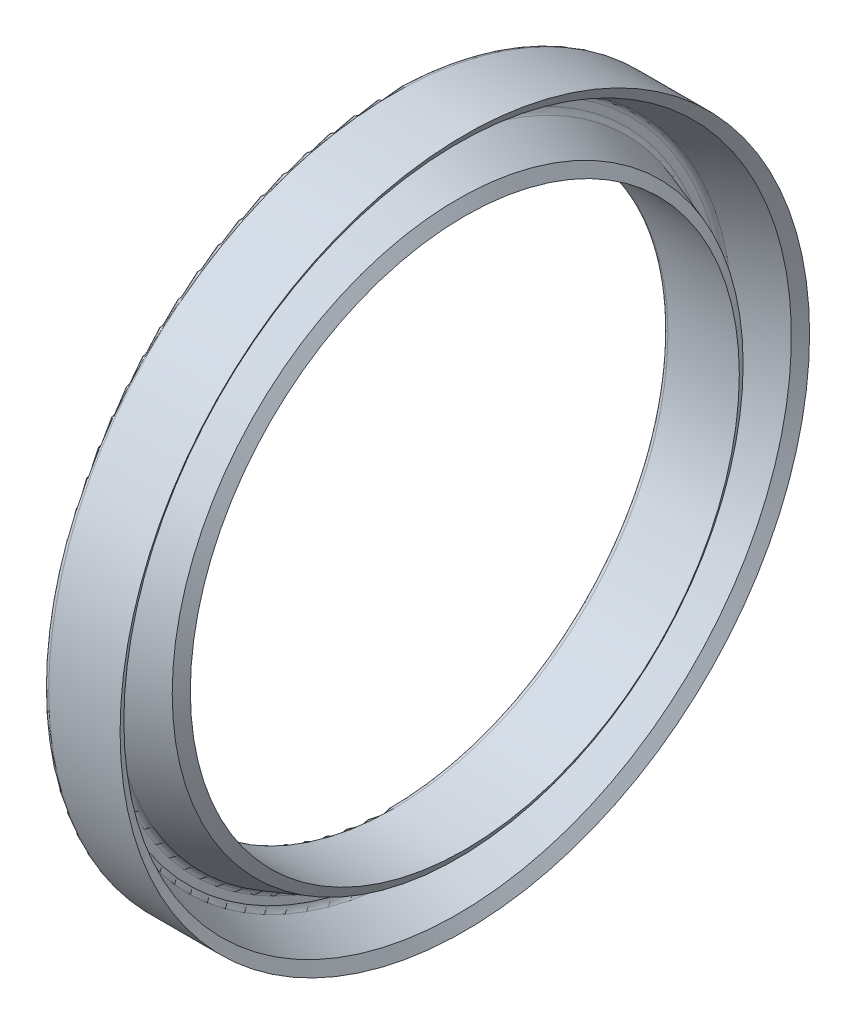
SolidWorks part; units mm, degrees
ref_plane "Face" through (0, 0, 0) normal (0, 0, 1) x (1, 0, 0)
ref_plane "Dessus" through (0, 0, 0) normal (0, 1, 0) x (1, 0, 0)
ref_plane "Droite" through (0, 0, 0) normal (1, 0, 0) x (0, 0, -1)
sketch "Esquisse1" plane through (0, 0, 0) normal (0, 0, 1) x (1, 0, 0)
  line L0 (0, 0) -> (20.2268, 0) construction
  line L1 (7, 31.4) -> (0.5, 31.4)
  line L2 (0, 30.9) -> (0, 25.5)
  line L3 (0.5, 25) -> (7, 25)
  line L4 (7, 25) -> (6.35, 26)
  line L5 (6.35, 26) -> (2.337, 27.3838)
  line L6 (2, 27.8565) -> (2, 28.5436)
  line L7 (2.3369, 29.0163) -> (6.3464, 30.4)
  line L8 (6.3464, 30.4) -> (7, 31.4)
  arc A0 (0, 30.9) -> (0.5, 31.4) centre (0.5, 30.9) cw
  arc A1 (0.5, 25) -> (0, 25.5) centre (0.5, 25.5) cw
  arc A2 (2, 28.5436) -> (2.3369, 29.0163) centre (2.5, 28.5436) cw
  arc A3 (2.337, 27.3838) -> (2, 27.8565) centre (2.5, 27.8565) cw
  point P15 (0, 25)
  point P18 (2, 28.9)
  point P21 (2, 27.5)
  dimension "D12" = 0.5
  dimension "D1" = 7
  dimension "D2" = 2
  dimension "D3" = 25
  dimension "D4" = 31.4
  dimension "D5" = 0.6536
  dimension "D6" = 0.65
  dimension "D7" = 1
  dimension "D8" = 1
  dimension "D9" = 1.5
  dimension "D10" = 1.5
  dimension "D11" = 7
revolve "Révolution1" add sketch "Esquisse1" angle 360 about L0
